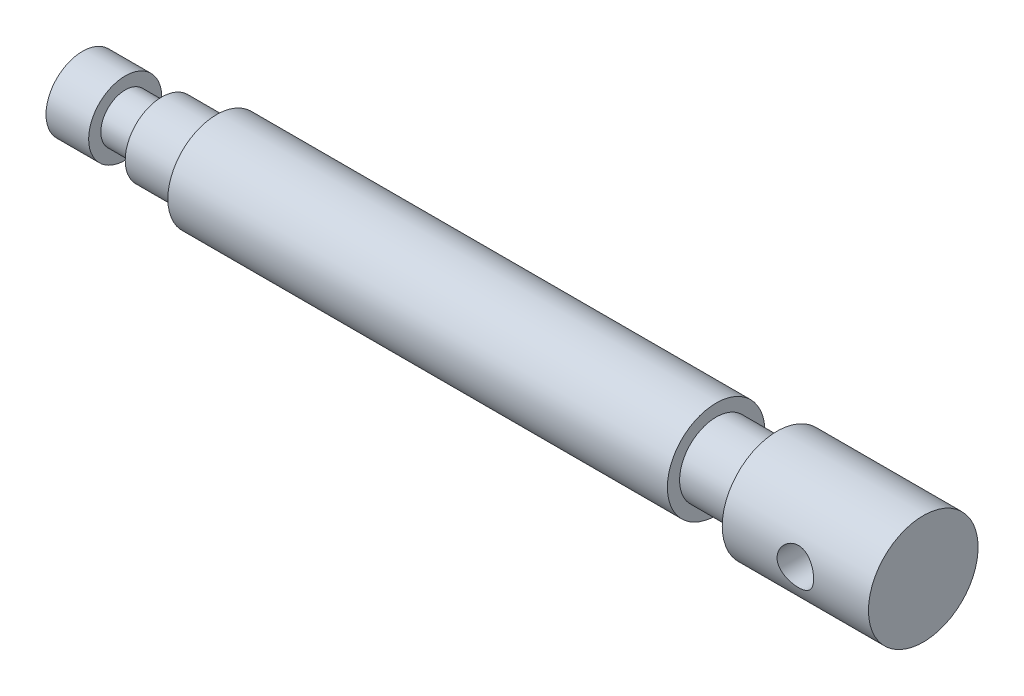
SolidWorks part; units mm, degrees
ref_plane "Front" through (0, 0, 0) normal (0, 0, 1) x (1, 0, 0)
ref_plane "Top" through (0, 0, 0) normal (0, 1, 0) x (1, 0, 0)
ref_plane "Right" through (0, 0, 0) normal (1, 0, 0) x (0, 0, -1)
sketch "Sketch1" plane through (0, 0, 0) normal (0, 0, 1) x (1, 0, 0)
  line L0 (0, 0) -> (152.417, 0) construction
  line L1 (0, 0) -> (0, 6)
  line L2 (0, 6) -> (7, 6)
  line L5 (13, 4) -> (13, 6)
  line L6 (13, 6) -> (22, 6)
  line L7 (22, 6) -> (22, 8)
  line L8 (22, 8) -> (104, 8)
  line L9 (104, 8) -> (104, 6)
  line L10 (104, 6) -> (114, 6)
  line L11 (114, 6) -> (114, 9)
  line L12 (114, 9) -> (138, 9)
  line L13 (138, 9) -> (138, 0)
  line L14 (138, 0) -> (0, 0)
  line L15 (7, 6) -> (7, 4)
  line L16 (7, 4) -> (13, 4)
  dimension "D1" = 12
  dimension "D2" = 12
  dimension "D3" = 7
  dimension "D4" = 16
  dimension "D5" = 12
  dimension "D6" = 18
  dimension "D7" = 6
  dimension "D8" = 8
  dimension "D9" = 82
  dimension "D10" = 10
  dimension "D11" = 24
  dimension "D12" = 138
revolve "Revolve1" add sketch "Sketch1" angle 360 about L0
sketch "Sketch2" plane through (0, 0, 0) normal (0, 0, 1) x (1, 0, 0)
  line L0 (138, -9) -> (138, 9) construction
  circle A0 centre (126, 0) radius 3
  dimension "D2" = 6
  dimension "D1" = 12
extrude "Cut-Extrude1" cut sketch "Sketch2" against normal through all and the other way through all
